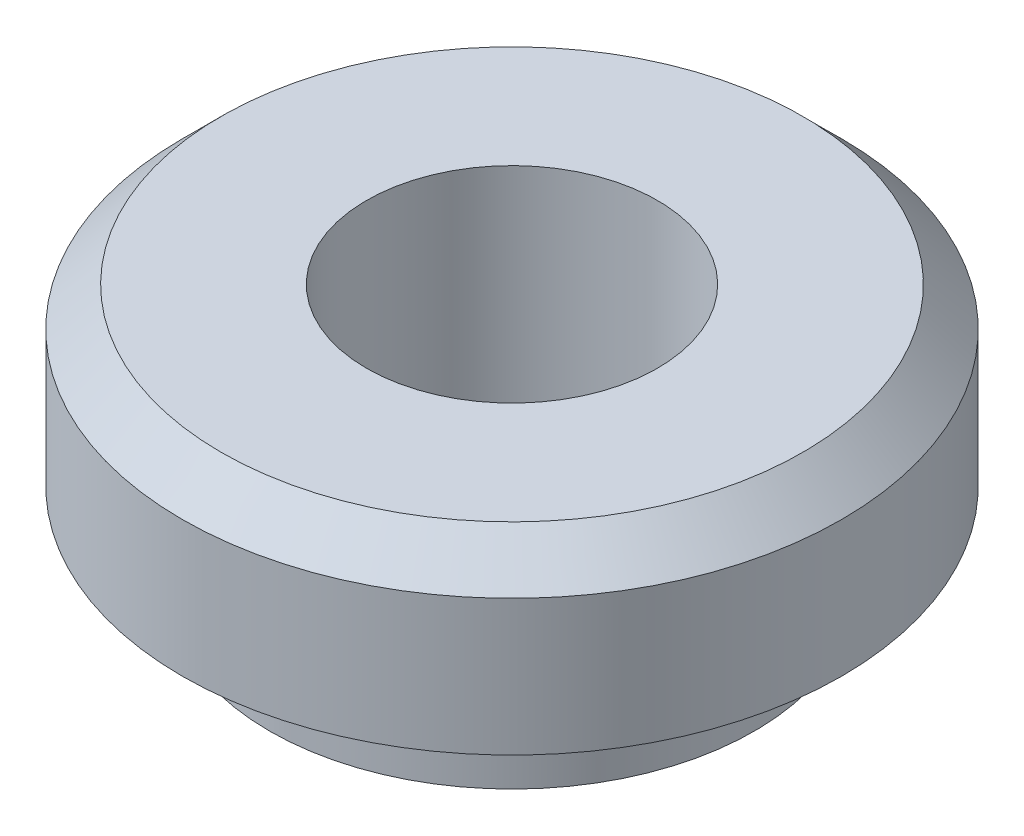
SolidWorks part; units mm, degrees
ref_plane "Front" through (0, 0, 0) normal (0, 0, 1) x (1, 0, 0)
ref_plane "Top" through (0, 0, 0) normal (0, 1, 0) x (1, 0, 0)
ref_plane "Side" through (0, 0, 0) normal (1, 0, 0) x (0, 0, -1)
sketch "Sketch1" plane through (0, 0, 0) normal (1, 0, 0) x (0, 0, -1)
  line L0 (1.905, -1.1938) -> (1.905, 2.286)
  line L1 (1.905, 2.286) -> (3.81, 2.286)
  line L2 (3.81, 2.286) -> (4.318, 1.778)
  line L3 (4.318, 1.778) -> (4.318, 0)
  line L4 (4.318, 0) -> (3.175, 0)
  line L5 (3.175, 0) -> (3.175, -1.1938)
  line L6 (3.175, -1.1938) -> (1.905, -1.1938)
  line L7 (0, 5.08) -> (0, -5.08) construction
  dimension "D1" = 1.905
  dimension "D2" = 3.175
  dimension "D3" = 0.508
  dimension "D4" = 0.508
  dimension "D5" = 4.318
  dimension "D6" = 2.286
  dimension "D7" = 1.1938
revolve "Base-Revolve" add sketch "Sketch1" angle 360 about L7
